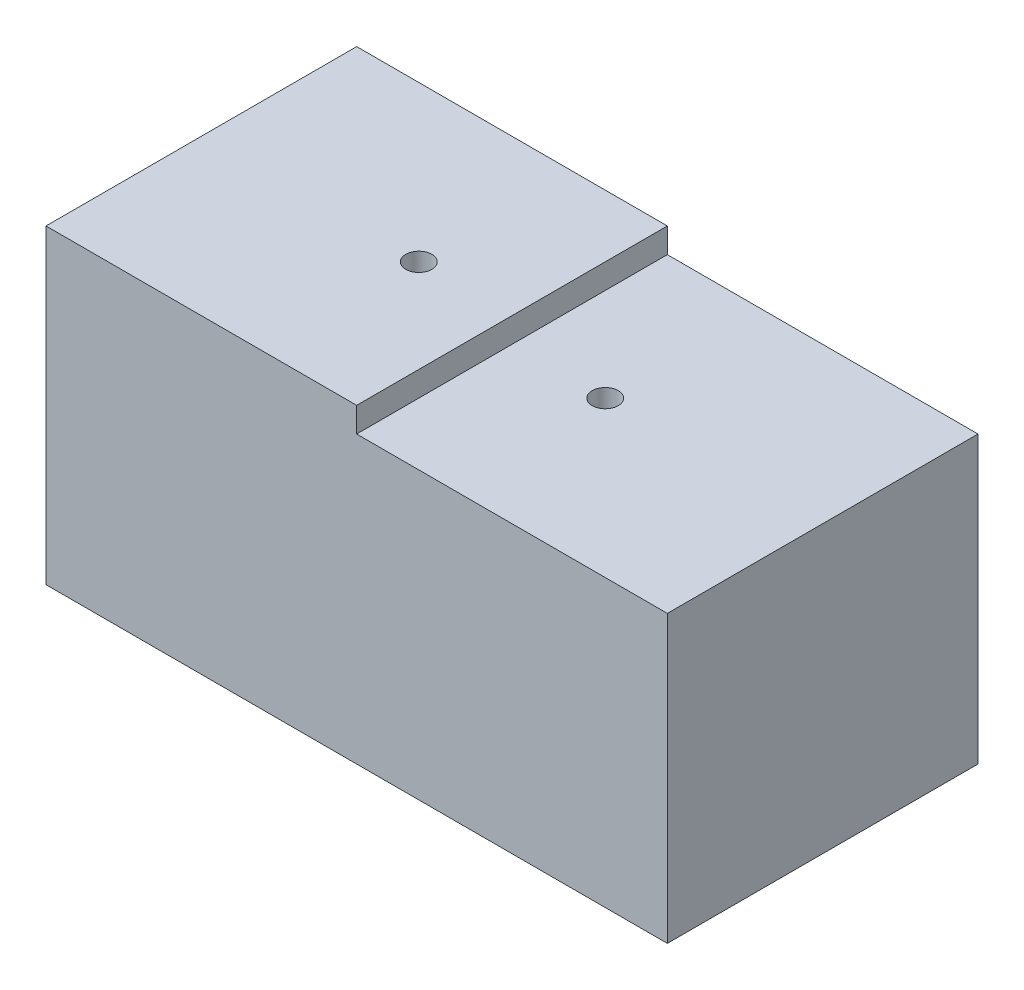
SolidWorks part; units mm, degrees
ref_plane "Vorderansicht" through (0, 0, 0) normal (0, 0, 1) x (1, 0, 0)
ref_plane "Draufsicht" through (0, 0, 0) normal (0, 1, 0) x (1, 0, 0)
ref_plane "Seitenansicht" through (0, 0, 0) normal (1, 0, 0) x (0, 0, -1)
sketch "Sketch1" plane through (0, 0, 0) normal (0, 0, 1) x (1, 0, 0)
  line L0 (50, 25) -> (-50, -25) construction
  line L1 (50, 25) -> (-50, 25)
  line L2 (50, 25) -> (50, -25)
  line L3 (50, -25) -> (-50, -25)
  line L4 (-50, 25) -> (-50, -25)
  line L5 (-50, 25) -> (50, -25) construction
  dimension "D1" = 100
  dimension "D2" = 50
extrude "Extrude1" add sketch "Sketch1" along normal mid plane 50
sketch "Sketch2" plane through (0, 0, 25) normal (0, 0, 1) x (1, 0, 0)
  line L1 (50, 25) -> (0, 25)
  line L2 (50, 25) -> (50, 21)
  line L3 (50, 21) -> (0, 21)
  line L4 (0, 25) -> (0, 21)
  dimension "D1" = 4
extrude "Cut-Extrude1" cut sketch "Sketch2" against normal up to next
sketch "Sketch3" plane through (0, 25, 0) normal (0, 1, 0) x (-1, 0, 0)
  circle A0 centre (15, 0) radius 2.1
  dimension "D1" = 4.2
  dimension "D2" = 15
extrude "Cut-Extrude2" cut sketch "Sketch3" against normal blind 20
sketch "Sketch4" plane through (0, 5, 0) normal (0, 1, 0) x (-1, 0, 0)
  circle A1 centre (15, 0) radius 2.1
  circle A2 centre (15, 0) radius 2.1
  dimension "D1" = 0
extrude "Cut-Extrude3" cut sketch "Sketch4" against normal up to next (30 mm away) draft 59
pattern_linear "LPattern1" count 2 spacing 30 along (1, 0, 0) of "Cut-Extrude2", "Cut-Extrude3"
